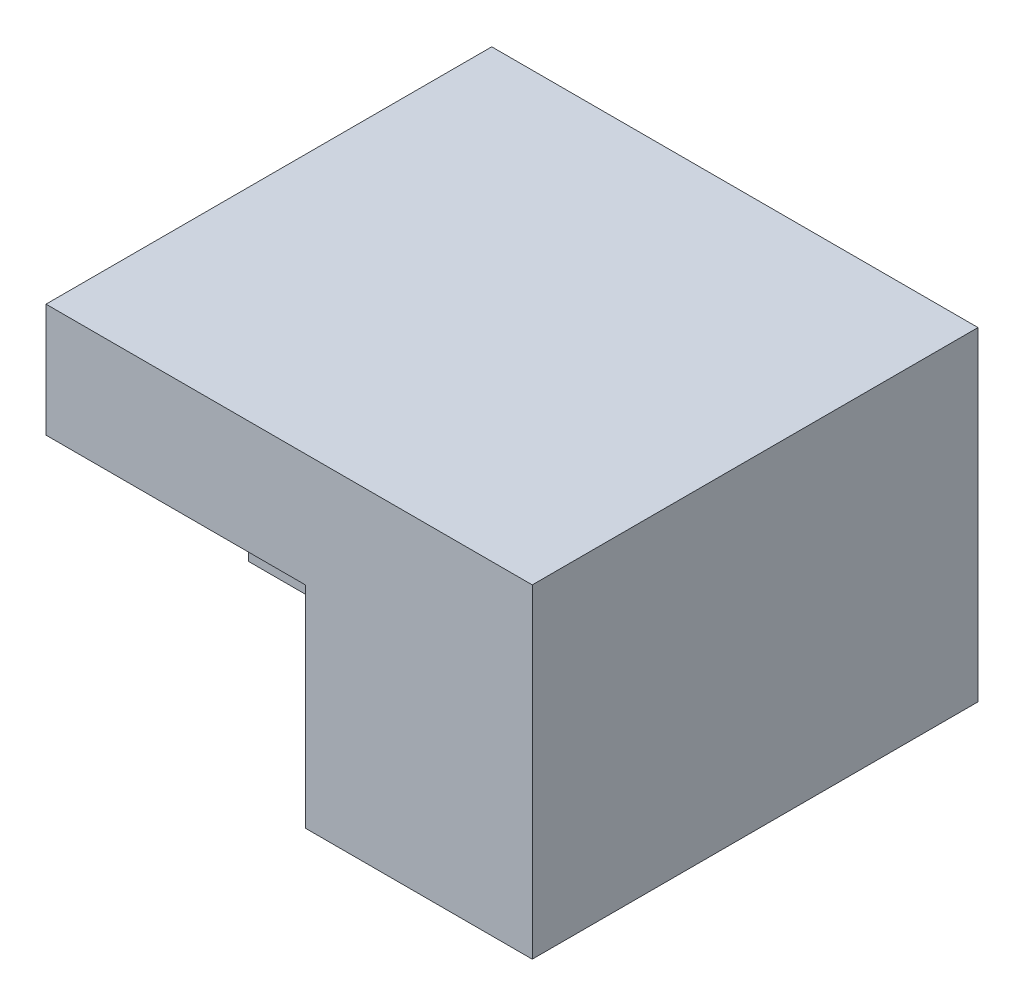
SolidWorks part; units mm, degrees
ref_plane "前视基准面" through (0, 0, 0) normal (0, 0, 1) x (1, 0, 0)
ref_plane "上视基准面" through (0, 0, 0) normal (0, 1, 0) x (1, 0, 0)
ref_plane "右视基准面" through (0, 0, 0) normal (1, 0, 0) x (0, 0, -1)
sketch "草图1" plane through (0, 0, 0) normal (0, 0, 1) x (1, 0, 0)
  line L1 (0, 0) -> (-60, 0)
  line L2 (0, 0) -> (0, 40)
  line L3 (0, 40) -> (-60, 40)
  line L4 (-60, 0) -> (-60, 40)
  dimension "D1" = 60
  dimension "D2" = 40
extrude "拉伸1" add sketch "草图1" along normal blind 55
sketch "草图2" plane through (0, 0, 55) normal (0, 0, 1) x (1, 0, 0)
  line L1 (-60, 0) -> (-28, 0)
  line L2 (-60, 0) -> (-60, 26)
  line L3 (-60, 26) -> (-28, 26)
  line L4 (-28, 0) -> (-28, 26)
  dimension "D1" = 26
  dimension "D2" = 32
extrude "切除-拉伸1" cut sketch "草图2" against normal blind 25
